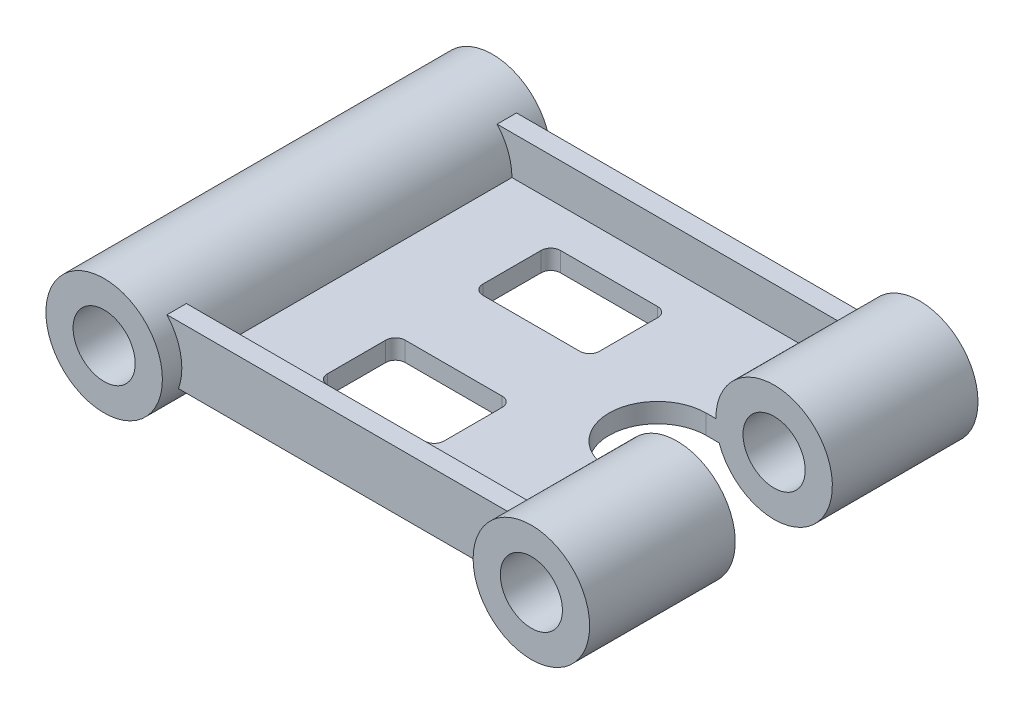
SolidWorks part; units mm, degrees
ref_plane "前视基准面" through (0, 0, 0) normal (0, 0, 1) x (1, 0, 0)
ref_plane "上视基准面" through (0, 0, 0) normal (0, 1, 0) x (1, 0, 0)
ref_plane "右视基准面" through (0, 0, 0) normal (1, 0, 0) x (0, 0, -1)
sketch "草图1" plane through (0, 0, 0) normal (0, 0, 1) x (1, 0, 0)
  line L0 (0, 0) -> (199.9865, 0) construction
  circle A0 centre (0, 0) radius 30
  circle A1 centre (220, 0) radius 30
  dimension "D1" = 60
  dimension "D2" = 60
  dimension "D3" = 220
extrude "拉伸1" add sketch "草图1" along normal mid plane 200
sketch "草图2" plane through (0, 0, 0) normal (0, 0, 1) x (1, 0, 0)
  line L0 (0, 0) -> (220, 0) construction
  line L1 (30, 0) -> (190, 0)
  line L2 (28.2843, -10) -> (191.7157, -10)
  circle A0 centre (0, 0) radius 30 construction
  circle A1 centre (220, 0) radius 30 construction
  arc A2 (28.2843, -10) -> (30, 0) centre (0, 0) ccw
  arc A3 (190, 0) -> (191.7157, -10) centre (220, 0) ccw
  dimension "D1" = 10
extrude "拉伸2" add sketch "草图2" along normal mid plane 180
sketch "草图3" plane through (0, 0, 100) normal (0, 0, 1) x (1, 0, 0)
  circle A0 centre (0, 0) radius 16
  circle A1 centre (220, 0) radius 16
  dimension "D1" = 32
  dimension "D2" = 32
extrude "切除-拉伸1" cut sketch "草图3" against normal through all
sketch "草图4" plane through (0, 0, 90) normal (0, 0, 1) x (1, 0, 0)
  line L0 (22.3607, 20) -> (197.6393, 20)
  line L1 (190, 0) -> (30, 0) construction
  line L2 (190, 0) -> (30, 0)
  circle A0 centre (0, 0) radius 30 construction
  circle A1 centre (220, 0) radius 30 construction
  arc A2 (197.6393, 20) -> (190, 0) centre (220, 0) ccw
  arc A3 (30, 0) -> (22.3607, 20) centre (0, 0) ccw
  dimension "D1" = 20
extrude "拉伸3" add sketch "草图4" against normal blind 10
mirror "镜向1" about plane through (0, 0, 0) normal (0, 0, 1) of "拉伸3"
ref_plane "基准面1" through (0, 30, 0) normal (0, 1, 0) x (-1, 0, 0)
sketch "草图5" plane through (0, 30, 0) normal (0, 1, 0) x (-1, 0, 0)
  line L0 (0, 0) -> (-311.4532, 0) construction
  line L1 (-190, 80) -> (-190, -80) construction
  line L2 (-286.0487, 25) -> (-185, 25)
  line L3 (-286.0487, 25) -> (-286.0487, -25)
  line L4 (-286.0487, -25) -> (-185, -25)
  arc A0 (-185, 25) -> (-185, -25) centre (-185, 0) cw
  dimension "D3" = 30
  dimension "D1" = 50
  dimension "D2" = 25
extrude "切除-拉伸2" cut sketch "草图5" against normal through all
sketch "草图6" plane through (0, 0, 0) normal (0, 1, 0) x (-1, 0, 0)
  line L0 (0, 0) -> (-213.995, 0) construction
  line L1 (-130, -60) -> (-70, -60)
  line L2 (-130, -60) -> (-130, -20)
  line L3 (-130, -20) -> (-70, -20)
  line L4 (-70, -60) -> (-70, -20)
  line L5 (-130, 20) -> (-70, 20)
  line L6 (-130, 20) -> (-130, 60)
  line L7 (-130, 60) -> (-70, 60)
  line L8 (-70, 20) -> (-70, 60)
  line L9 (-197.6393, -80) -> (-22.3607, -80) construction
  line L10 (-30, 80) -> (-30, -80) construction
  line L11 (-30, 80) -> (-190, 80) construction
  dimension "D1" = 20
  dimension "D2" = 40
  dimension "D3" = 60
  dimension "D4" = 20
  dimension "D5" = 20
  dimension "D6" = 20
extrude "切除-拉伸3" cut sketch "草图6" against normal through all
fillet "圆角1" radius 5 8 edges at (130, -5, 20) (130, -5, 60) (70, -5, 60) (70, -5, 20) (70, -5, -60) (70, -5, -20) (130, -5, -20) (130, -5, -60)
